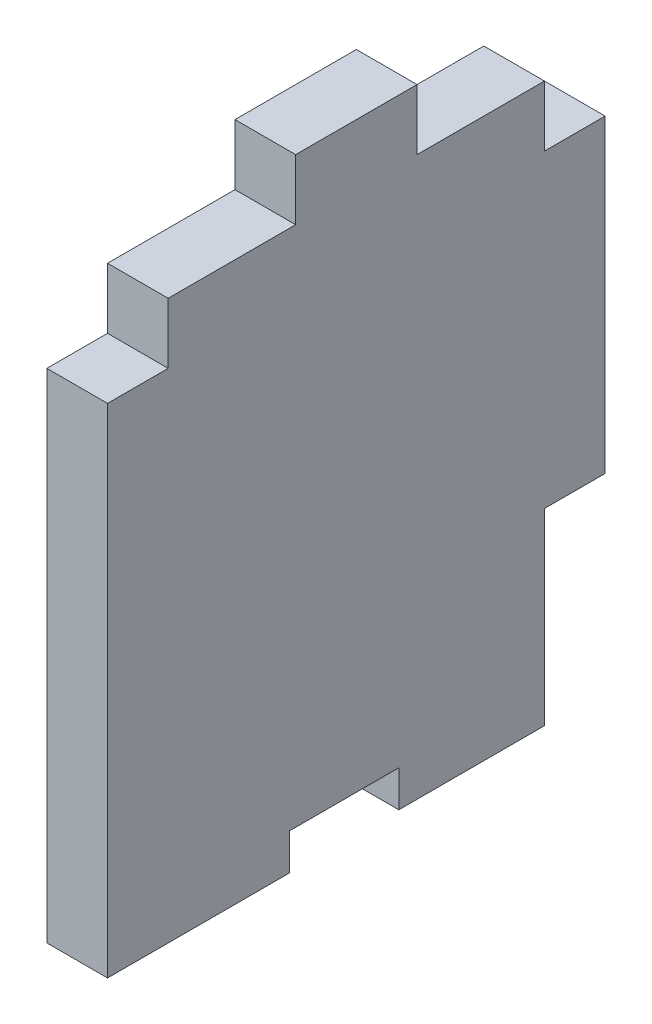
SolidWorks part; units mm, degrees
ref_plane "Plan de face" through (0, 0, 0) normal (0, 0, 1) x (1, 0, 0)
ref_plane "Plan de dessus" through (0, 0, 0) normal (0, 1, 0) x (1, 0, 0)
ref_plane "Plan de droite" through (0, 0, 0) normal (1, 0, 0) x (0, 0, -1)
sketch "Esquisse1" plane through (0, 0, 0) normal (1, 0, 0) x (0, 0, -1)
  line L1 (-20.5, 25.5) -> (20.5, 25.5)
  line L2 (-20.5, 25.5) -> (-20.5, -25.5)
  line L3 (-20.5, -25.5) -> (20.5, -25.5)
  line L4 (20.5, 25.5) -> (20.5, -25.5)
  line L5 (-20.5, 25.5) -> (20.5, -25.5) construction
  line L6 (-20.5, -25.5) -> (20.5, 25.5) construction
  point P0 (0, 0)
  dimension "D1" = 41
  dimension "D2" = 51
extrude "Boss.-Extru.1" add sketch "Esquisse1" along normal blind 5
sketch "Esquisse2" plane through (5, 0, 0) normal (1, 0, 0) x (0, 0, -1)
  line L6 (20.5, -25.5) -> (15.5, -25.5)
  line L7 (20.5, -25.5) -> (20.5, -10)
  line L8 (20.5, -10) -> (15.5, -10)
  line L9 (15.5, -25.5) -> (15.5, -10)
  line L10 (-20.5, 25.5) -> (-5, 25.5)
  line L11 (-20.5, 25.5) -> (-20.5, 20.5)
  line L12 (-20.5, 20.5) -> (-5, 20.5)
  line L13 (-5, 25.5) -> (-5, 20.5)
  line L14 (20.5, 25.5) -> (5, 25.5)
  line L15 (20.5, 25.5) -> (20.5, 20.5)
  line L16 (20.5, 20.5) -> (5, 20.5)
  line L17 (5, 25.5) -> (5, 20.5)
  dimension "D1" = 5
  dimension "D2" = 10
  dimension "D3" = 30.5
extrude "Enlèv. mat.-Extru.1" cut sketch "Esquisse2" against normal up to next
sketch "Esquisse3" plane through (5, 0, 0) normal (1, 0, 0) x (0, 0, -1)
  line L1 (-20.5, 20.5) -> (-15.5, 20.5)
  line L2 (-20.5, 20.5) -> (-20.5, 15.5)
  line L3 (-20.5, 15.5) -> (-15.5, 15.5)
  line L4 (-15.5, 20.5) -> (-15.5, 15.5)
  line L5 (20.5, 20.5) -> (15.5, 20.5)
  line L6 (20.5, 20.5) -> (20.5, 15.5)
  line L7 (20.5, 15.5) -> (15.5, 15.5)
  line L8 (15.5, 20.5) -> (15.5, 15.5)
  dimension "D1" = 5
  dimension "D2" = 5
extrude "Enlèv. mat.-Extru.2" cut sketch "Esquisse3" against normal up to next
sketch "Esquisse4" plane through (5, 0, 0) normal (1, 0, 0) x (0, 0, -1)
  line L0 (-20.5, -25.5) -> (15.5, -25.5) construction
  line L1 (-5.5, -25.5) -> (3.5, -25.5)
  line L2 (-5.5, -25.5) -> (-5.5, -22.5)
  line L3 (-5.5, -22.5) -> (3.5, -22.5)
  line L4 (3.5, -25.5) -> (3.5, -22.5)
  line L5 (20.5, -10) -> (20.5, 15.5) construction
  dimension "D1" = 17
  dimension "D2" = 26
  dimension "D3" = 3
extrude "Enlèv. mat.-Extru.3" cut sketch "Esquisse4" against normal up to next
